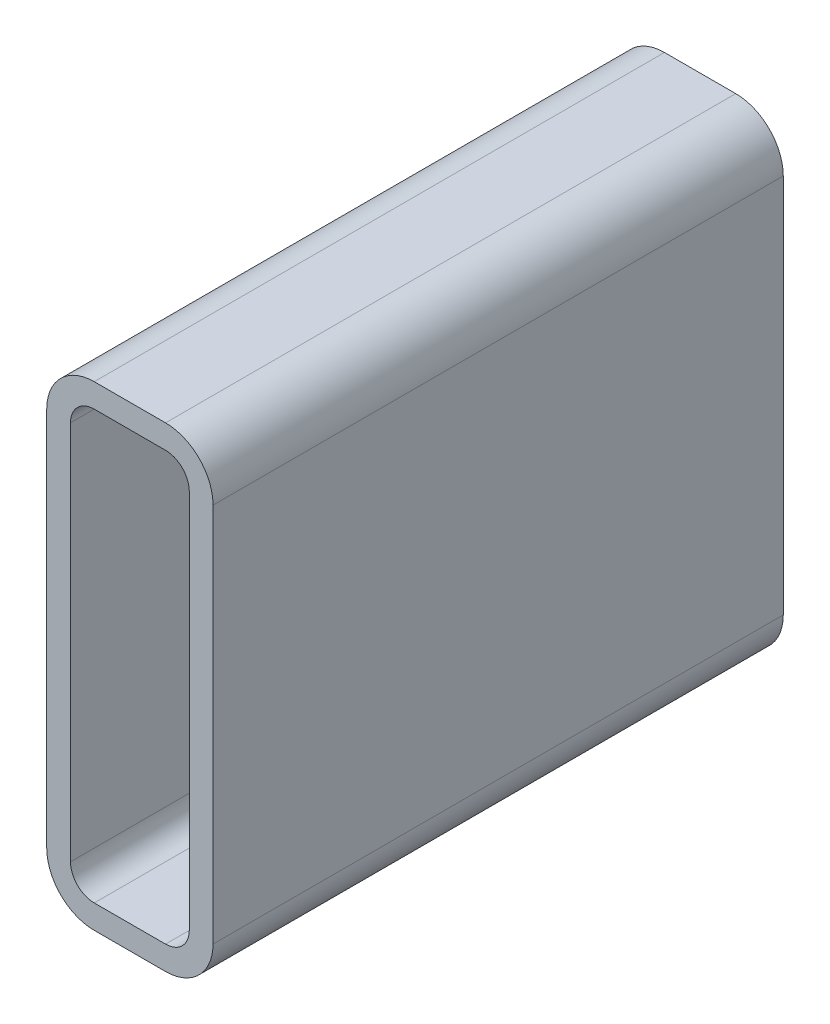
SolidWorks part; units mm, degrees
ref_plane "Front Plane" through (0, 0, 0) normal (0, 0, 1) x (1, 0, 0)
ref_plane "Top Plane" through (0, 0, 0) normal (0, 1, 0) x (1, 0, 0)
ref_plane "Right Plane" through (0, 0, 0) normal (1, 0, 0) x (0, 0, -1)
sketch "Sketch1" plane through (0, 0, 0) normal (0, 0, 1) x (1, 0, 0)
sketch_block_instance "HSS10x3.5x0.500-1"
sketch_block "HSS10x3.5x0.500"
extrude "Boss-Extrude1" add sketch "Sketch1" along normal blind 304.8
